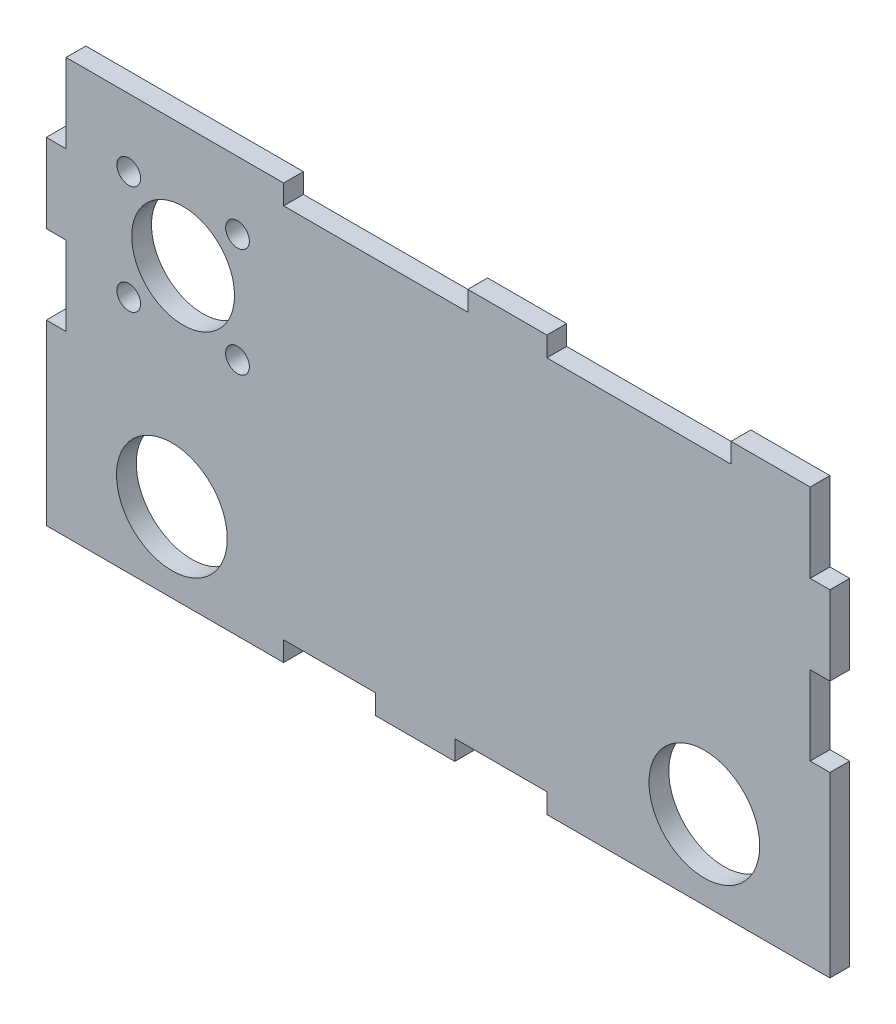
SolidWorks part; units mm, degrees
ref_plane "Front Plane" through (0, 0, 0) normal (0, 0, 1) x (1, 0, 0)
ref_plane "Top Plane" through (0, 0, 0) normal (0, 1, 0) x (1, 0, 0)
ref_plane "Right Plane" through (0, 0, 0) normal (1, 0, 0) x (0, 0, -1)
sketch "Sketch1" plane through (0, 0, 0) normal (0, 0, 1) x (1, 0, 0)
  line L0 (20.8422, 87.9243) -> (34.591, 74.1756) construction
  line L1 (0, 0) -> (198.12, 0) construction
  line L2 (0, 0) -> (0, 105) construction
  line L3 (0, 105) -> (198.12, 105) construction
  line L4 (198.12, 0) -> (198.12, 105) construction
  line L5 (34.591, 74.1756) -> (48.3398, 87.9243) construction
  line L6 (5, 105) -> (5, 0) construction
  line L7 (0, 0) -> (0, 45)
  line L8 (0, 45) -> (5, 45)
  line L9 (5, 45) -> (5, 65)
  line L10 (5, 65) -> (0, 65)
  line L11 (0, 65) -> (0, 85)
  line L12 (0, 85) -> (5, 85)
  line L13 (5, 85) -> (5, 105)
  line L14 (5, 105) -> (60, 105)
  line L15 (60, 105) -> (60, 100)
  line L16 (60, 100) -> (106.56, 100)
  line L17 (106.56, 100) -> (106.56, 105)
  line L18 (106.56, 105) -> (126.56, 105)
  line L19 (126.56, 105) -> (126.56, 100)
  line L20 (126.56, 100) -> (173.12, 100)
  line L21 (173.12, 100) -> (173.12, 105)
  line L22 (173.12, 105) -> (193.12, 105)
  line L23 (193.12, 105) -> (193.12, 85)
  line L24 (193.12, 85) -> (198.12, 85)
  line L25 (198.12, 85) -> (198.12, 65)
  line L26 (198.12, 65) -> (193.12, 65)
  line L27 (193.12, 65) -> (193.12, 45)
  line L28 (193.12, 45) -> (198.12, 45)
  line L29 (198.12, 45) -> (198.12, 0)
  line L30 (0, 0) -> (60, 0)
  line L31 (60, 0) -> (60, 5)
  line L32 (60, 5) -> (83.28, 5)
  line L33 (83.28, 5) -> (83.28, 0)
  line L34 (83.28, 0) -> (103.28, 0)
  line L35 (103.28, 0) -> (103.28, 5)
  line L36 (103.28, 5) -> (126.56, 5)
  line L37 (126.56, 5) -> (126.56, 0)
  line L38 (126.56, 0) -> (198.12, 0)
  circle A0 centre (31.75, 20) radius 14
  circle A1 centre (80.01, 46.3813) radius 14 construction
  circle A2 centre (118.11, 46.3813) radius 14 construction
  circle A3 centre (166.37, 20) radius 14
  circle A4 centre (31.75, 20) radius 55 construction
  circle A5 centre (31.75, 20) radius 31.75 construction
  circle A6 centre (166.37, 20) radius 55 construction
  circle A7 centre (166.37, 20) radius 31.75 construction
  circle A8 centre (31.75, 20) radius 54.25 construction
  circle A9 centre (34.591, 74.1756) radius 19.4437 construction
  circle A10 centre (20.8422, 87.9243) radius 3
  circle A11 centre (20.8422, 60.4268) radius 3
  circle A12 centre (48.3398, 60.4268) radius 3
  circle A13 centre (48.3398, 87.9243) radius 3
  circle A14 centre (34.591, 74.1756) radius 29.591 construction
  circle A15 centre (34.591, 74.1756) radius 13
  dimension "D1" = 63.5
  dimension "D2" = 28
  dimension "D5" = 110
  dimension "D8" = 108.5
  dimension "D9" = 38.8874
  dimension "D10" = 6
  dimension "D11" = 59.182
  dimension "D21" = 26
  dimension "D3" = 38.1
  dimension "D4" = 134.62
  dimension "D6" = 198.12
  dimension "D7" = 105
  dimension "D12" = 20
  dimension "D13" = 5
  dimension "D14" = 20
  dimension "D15" = 20
  dimension "D16" = 45
  dimension "D17" = 20
  dimension "D18" = 20
  dimension "D19" = 55
  dimension "D20" = 5
  dimension "D22" = 20
extrude "Boss-Extrude1" add sketch "Sketch1" along normal blind 5
